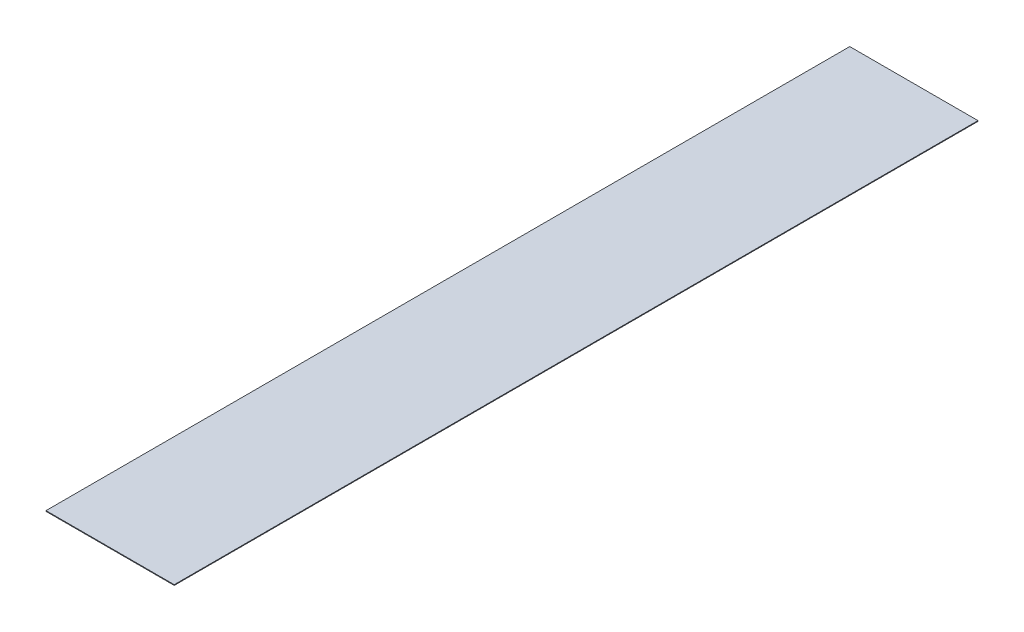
SolidWorks part; units mm, degrees
ref_plane "Front Plane" through (0, 0, 0) normal (0, 0, 1) x (1, 0, 0)
ref_plane "Top Plane" through (0, 0, 0) normal (0, 1, 0) x (1, 0, 0)
ref_plane "Right Plane" through (0, 0, 0) normal (1, 0, 0) x (0, 0, -1)
sketch "Sketch1" plane through (0, 0, 0) normal (0, 1, 0) x (1, 0, 0)
  line L0 (-47.625, 0) -> (0, 0)
  line L2 (0, 0) -> (0, -298.45)
  line L3 (0, -298.45) -> (-47.625, -298.45)
  line L4 (-47.625, 0) -> (-47.625, -298.45)
  dimension "D1" = 298.45
  dimension "D2" = 47.625
extrude "Boss-Extrude1" add sketch "Sketch1" along normal blind 0.254
